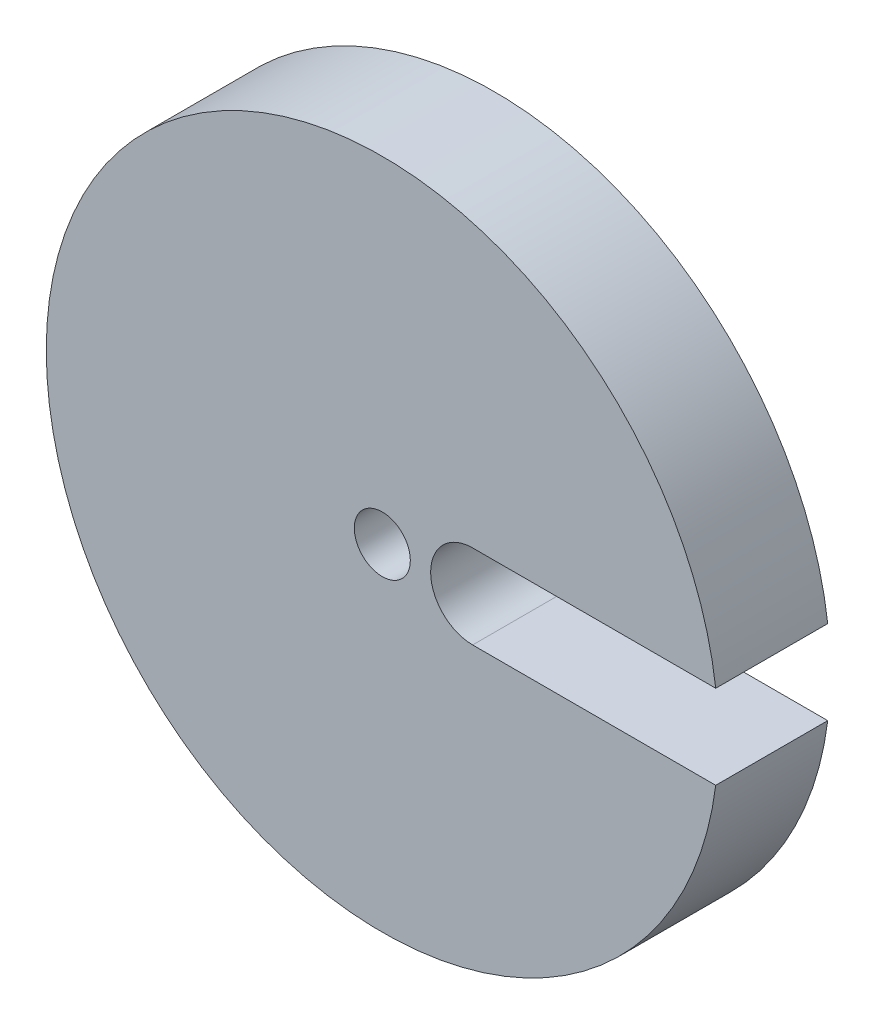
SolidWorks part; units mm, degrees
ref_plane "Frontal" through (0, 0, 0) normal (0, 0, 1) x (1, 0, 0)
ref_plane "Superior" through (0, 0, 0) normal (0, 1, 0) x (1, 0, 0)
ref_plane "Derecha" through (0, 0, 0) normal (1, 0, 0) x (0, 0, -1)
sketch "Croquis1" plane through (0, 0, 0) normal (0, 0, 1) x (1, 0, 0)
  circle A0 centre (0, 0) radius 60
  dimension "D1" = 120
extrude "Extruir1" add sketch "Croquis1" along normal blind 20
sketch "Croquis2" plane through (0, 0, 20) normal (0, 0, 1) x (1, 0, 0)
  circle A0 centre (0, 0) radius 5
  dimension "D1" = 10
extrude "Cortar-Extruir1" cut sketch "Croquis2" against normal blind 20
sketch "Croquis3" plane through (0, 0, 20) normal (0, 0, 1) x (1, 0, 0)
  line L0 (16.1288, 7.5) -> (59.5294, 7.5)
  line L1 (16.1288, -7.5) -> (59.5294, -7.5)
  line L2 (59.5294, -7.5) -> (72.4895, -7.5)
  line L3 (72.4895, -7.5) -> (72.4895, 7.5)
  line L4 (72.4895, 7.5) -> (59.5294, 7.5)
  arc A0 (16.1288, 7.5) -> (16.1288, -7.5) centre (16.1288, 0) ccw
  circle A1 centre (0, 0) radius 60 construction
  dimension "D1" = 15
extrude "Cortar-Extruir2" cut sketch "Croquis3" against normal blind 20
